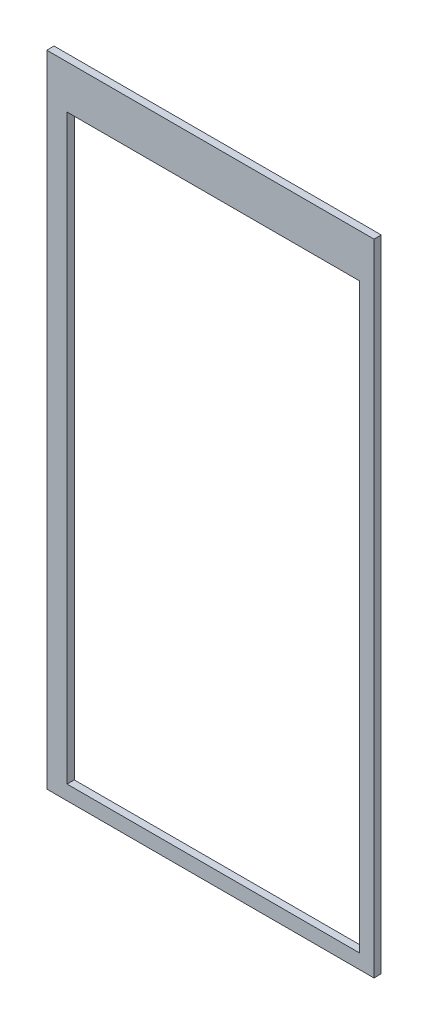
SolidWorks part; units mm, degrees
other "<hingep1>-<Extrude1>"
other "<hingep1>-<Extrude1>"
ref_plane "Plane1" through (0, 0, 0) normal (0, 0, 1) x (1, 0, 0)
ref_plane "Plane2" through (0, 0, 0) normal (0, 1, 0) x (1, 0, 0)
ref_plane "Plane3" through (0, 0, 0) normal (1, 0, 0) x (0, 0, -1)
imported_body "Imported1"
inserted part "hingep1"
move or copy body "Body-Move/Copy4" placed by mates yes
other "Distance5" parameters "D1"=105
other "Distance6" parameters "D1"=17.5
inserted part "hingep14"
move or copy body "Body-Move/Copy6" placed by mates yes
other "Distance7" parameters "D1"=105
other "Distance8" parameters "D1"=17.5
